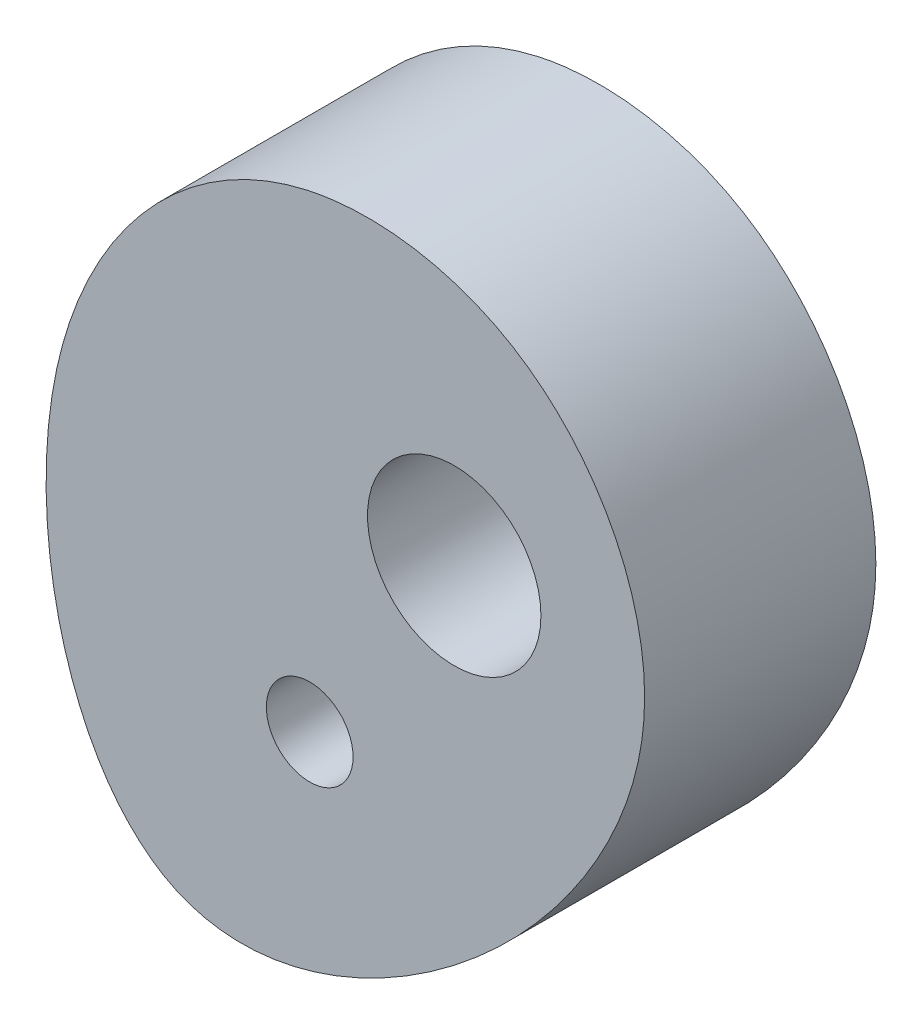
SolidWorks part; units mm, degrees
ref_plane "Front Plane" through (0, 0, 0) normal (0, 0, 1) x (1, 0, 0)
ref_plane "Top Plane" through (0, 0, 0) normal (0, 1, 0) x (1, 0, 0)
ref_plane "Right Plane" through (0, 0, 0) normal (1, 0, 0) x (0, 0, -1)
sketch "Sketch1" plane through (0, 0, 0) normal (0, 0, 1) x (1, 0, 0)
  circle A0 centre (0, 0) radius 3
  spline S0 degree 3 poles (-16.3469, -0.2723) (-7.4938, 9.8771) (3.5898, 8.3492) (10.8145, -5.1011) (-11.0334, -22.4889) (-16.3469, -0.2723) (-7.4938, 9.8771) (3.5898, 8.3492) knots -0.734962 -0.416363 -0.198083 0 0.109458 0.265038 0.583637 0.801917 1 1.109458 1.265038 1.583637 only from (-5.0964, 8.7042) to (-5.0964, 8.7042)
  dimension "D1" = 6
extrude "Extrude1" add sketch "Sketch1" along normal mid plane 8
sketch "Sketch2" plane through (0, 0, 4) normal (0, 0, 1) x (1, 0, 0)
  line L0 (0, 0) -> (-5, -7.4833) construction
  circle A0 centre (-5, -7.4833) radius 1.5
  dimension "D2" = 3
  dimension "D1" = 9
  dimension "D3" = 5
extrude "Cut-Extrude1" cut sketch "Sketch2" against normal through all
